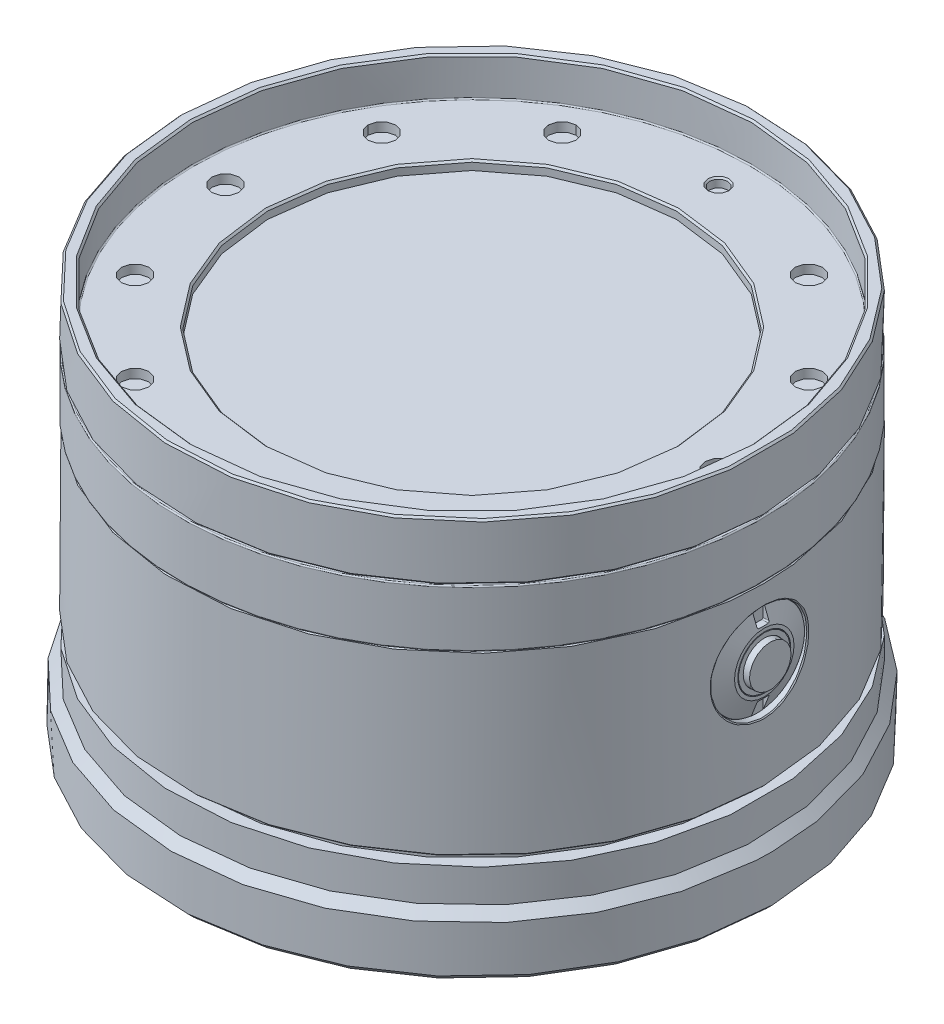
SolidWorks part; units mm, degrees
ref_plane "Front" through (0, 0, 0) normal (0, 0, 1) x (1, 0, 0)
ref_plane "Top" through (0, 0, 0) normal (0, 1, 0) x (1, 0, 0)
ref_plane "Right" through (0, 0, 0) normal (1, 0, 0) x (0, 0, -1)
imported_body "C20末端力控传感器-定制沟通方案-20251011-2-1-solid1"
imported_body "C20末端力控传感器-定制沟通方案-20251011-2-1-solid4"
imported_body "C20末端力控传感器-定制沟通方案-20251011-2-1-solid5"
imported_body "C20末端力控传感器-定制沟通方案-20251011-2-1-solid8"
imported_body "C20末端力控传感器-定制沟通方案-20251011-2-1-solid9"
imported_body "C20末端力控传感器-定制沟通方案-20251011-2-1-solid10"
imported_body "C20末端法兰转接件-1-solid1"
imported_body "C20散光环-1-solid1"
combine bodies "组合1" operation type add bodies to combine 102 112
combine bodies "组合3" operation type add bodies to combine 114 105
sketch "草图1" plane through (0, 9.3, 0) normal (0, -1, 0) x (1, 0, 0)
  circle A0 centre (0, 0) radius 46.7 construction
  circle A1 centre (0, 0) radius 46.7
extrude "凸台-拉伸1" add sketch "草图1" along normal mid plane 5
combine bodies "组合8" operation type add bodies to combine 113 116
sketch "草图2" plane through (0, 11.8, 0) normal (0, 1, 0) x (1, 0, 0)
  circle A0 centre (0, 0) radius 46.7 construction
  circle A1 centre (0, 0) radius 46.7
extrude "凸台-拉伸3" add sketch "草图2" along normal up to surface (38 mm away)
sketch "草图3" plane through (0, 5.3, 0) normal (0, 1, 0) x (1, 0, 0)
  circle A1 centre (0, 0) radius 42.5
  circle A2 centre (0, 0) radius 42.5
  dimension "D1" = 0
extrude "凸台-拉伸4" add sketch "草图3" along normal blind 3
sketch "草图4" plane through (0, 5.3, 0) normal (0, -1, 0) x (1, 0, 0)
  circle A1 centre (0, 0) radius 1.5
  circle A2 centre (0, 0) radius 1.5
  dimension "D1" = 0
extrude "凸台-拉伸5" add sketch "草图4" along normal blind 3
